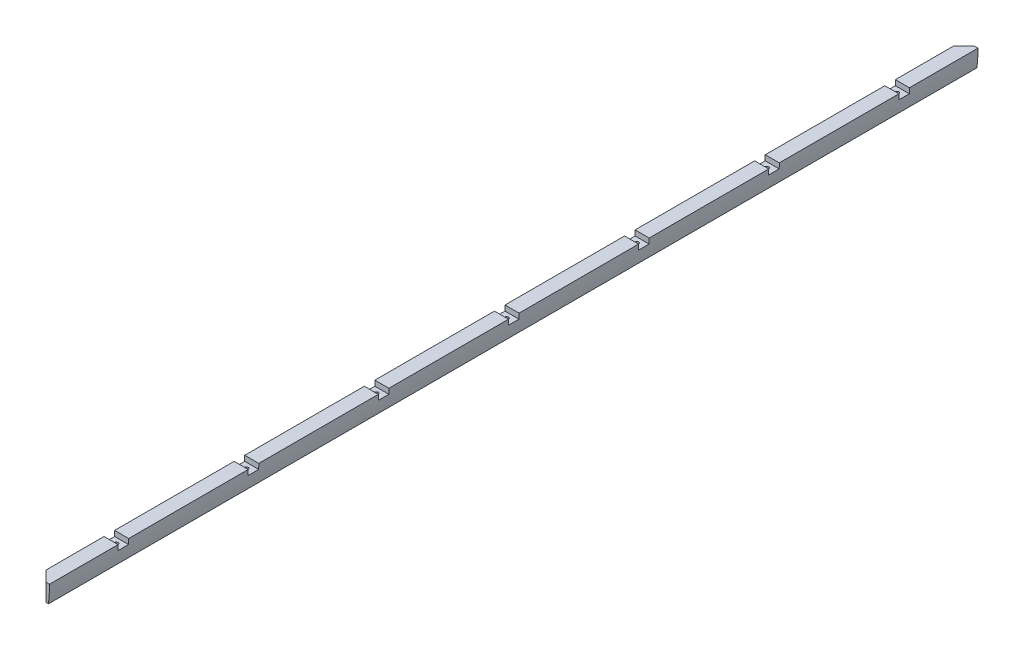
SolidWorks part; units mm, degrees
extrude "Base-Extrude" add sketch "Sketch1" along normal blind 1676.4
sketch "Sketch1" plane through (0, 0, 0) normal (0, 0, 1) x (1, 0, 0)
  line L0 (234.95, 0) -> (260.35, 0)
  line L1 (234.95, 0) -> (234.95, -31.75)
  line L2 (234.95, -31.75) -> (258.4068, -31.75)
  arc A0 (258.4068, -31.75) -> (260.35, 0) centre (0, 0) ccw
  dimension "D1" = 520.7
  dimension "D2" = 31.75
  dimension "D3" = 25.4
ref_plane "Plane1" through (0, 0, 0) normal (0, 0, 1) x (1, 0, 0)
ref_plane "Plane2" through (0, 0, 0) normal (0, 1, 0) x (1, 0, 0)
ref_plane "Plane3" through (0, 0, 0) normal (1, 0, 0) x (0, 0, -1)
sketch "Sketch2" plane through (0, 0, 0) normal (0, 1, 0) x (-1, 0, 0)
  line L0 (-260.35, 0) -> (-234.95, 0) construction
  line L1 (-352.3978, 123.825) -> (-155.5225, 123.825)
  line L2 (-352.3978, 123.825) -> (-352.3978, 142.875)
  line L3 (-352.3978, 142.875) -> (-155.5225, 142.875)
  line L4 (-155.5225, 123.825) -> (-155.5225, 142.875)
extrude "SlotCuts" cut sketch "Sketch2" against normal blind 9.525
pattern_linear "LPattern1" count 7 spacing 234.95 along (0, 0, 1) of "SlotCuts"
sketch "Sketch3" plane through (0, 0, 0) normal (0, 1, 0) x (-1, 0, 0)
  line L0 (-254, 1676.4) -> (-234.95, 1657.35)
  line L1 (-260.35, 1676.4) -> (-234.95, 1676.4) construction
  line L2 (-234.95, 1676.4) -> (-234.95, 1552.575) construction
  line L3 (-234.95, 1657.35) -> (-234.95, 1676.4)
  line L4 (-234.95, 1676.4) -> (-254, 1676.4)
  line L5 (-254, 0) -> (-234.95, 19.05)
  line L6 (-260.35, 0) -> (-234.95, 0) construction
  line L7 (-234.95, 123.825) -> (-234.95, 0) construction
  line L8 (-234.95, 19.05) -> (-234.95, 0)
  line L9 (-234.95, 0) -> (-254, 0)
  dimension "D1" = 19.05
  dimension "D2" = 19.05
  dimension "D3" = 19.05
  dimension "D4" = 19.05
extrude "RingClearance" cut sketch "Sketch3" against normal through all
hole_wizard "1/4 Clearance Hole1" positions "Sketch6" profile "Sketch5" hole size "1/4" standard "Ansi Inch"
sketch "Sketch6" plane through (0, -9.525, 0) normal (0, 1, 0) x (-1, 0, 0)
  line L0 (-247.5629, 106.5918) -> (-247.5629, 156.9301) construction
  line L2 (-234.95, 142.875) -> (-234.95, 123.825) construction
  line L3 (-260.1757, 123.825) -> (-260.1757, 142.875) construction
  line L12 (-226.3398, 133.35) -> (-268.4207, 133.35) construction
  line L14 (-260.1757, 123.825) -> (-234.95, 123.825) construction
  line L15 (-234.95, 142.875) -> (-260.1757, 142.875) construction
  point P0 (-247.5629, 133.35)
sketch "Sketch5" plane through (247.5629, -9.525, 133.35) normal (1, 0, 0) x (0, 0, 1)
  line L0 (0, 0) -> (0, 22.225)
  line L1 (0, 22.225) -> (3.3782, 22.225)
  line L2 (3.3782, 22.225) -> (3.3782, 0)
  line L5 (3.3782, 0) -> (0, 0)
  line L11 (0, -6.35) -> (0, 107.95) construction
  dimension "Thru Hole Dia." = 6.7564
  dimension "Thru Hole Depth" = 22.225
pattern_linear "LPattern2" count 7 spacing 234.95 along (0, 0, 1) of "1/4 Clearance Hole1"
equation "\"D2@Sketch2\" = (\"D1@Base-Extrude\"-\"D3@LPattern1\"*(\"D1@LPattern1\"-1)-\"D1@Sketch2\")/2"
